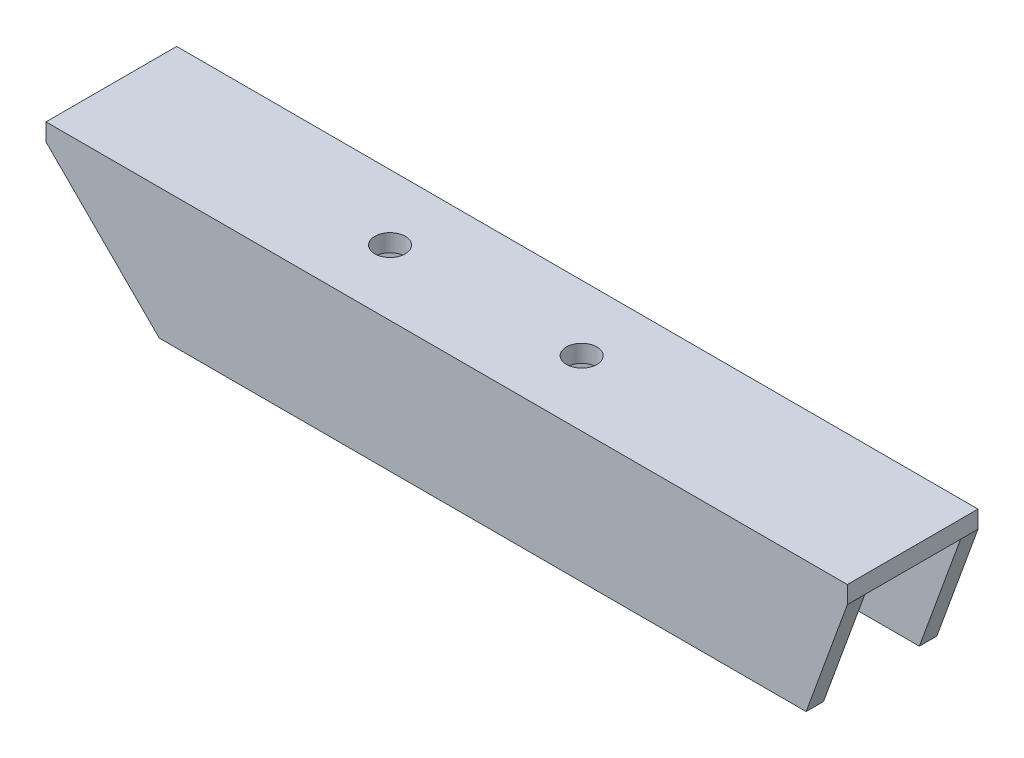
SolidWorks part; units mm, degrees
ref_plane "Front Plane" through (0, 0, 0) normal (0, 0, 1) x (1, 0, 0)
ref_plane "Top Plane" through (0, 0, 0) normal (0, 1, 0) x (1, 0, 0)
ref_plane "Right Plane" through (0, 0, 0) normal (1, 0, 0) x (0, 0, -1)
sketch "Sketch1" plane through (0, 0, 0) normal (1, 0, 0) x (0, 0, -1)
  line L0 (0, 0) -> (0, 15)
  line L1 (0, 15) -> (15, 15)
  line L2 (15, 15) -> (15, 0)
  line L3 (15, 0) -> (13, 0)
  line L4 (13, 0) -> (13, 13)
  line L5 (13, 13) -> (2, 13)
  line L6 (2, 13) -> (2, 0)
  line L7 (2, 0) -> (0, 0)
  dimension "D1" = 2
  dimension "D2" = 2
  dimension "D3" = 2
  dimension "D4" = 15
  dimension "D5" = 15
extrude "Boss-Extrude1" add sketch "Sketch1" along normal blind 92
sketch "Sketch2" plane through (0, 0, 0) normal (0, 0, 1) x (1, 0, 0)
  line L0 (0, 13) -> (13, 0)
  line L1 (92, 0) -> (0, 0) construction
  line L2 (13, 0) -> (0, 0)
  line L3 (0, 0) -> (0, 13)
  line L4 (92, 13) -> (92, 0)
  line L5 (92, 0) -> (87.2684, 0)
  line L6 (87.2684, 0) -> (92, 13)
  dimension "D1" = 45
  dimension "D2" = 70
extrude "Cut-Extrude1" cut sketch "Sketch2" against normal blind 92
sketch "Sketch3" plane through (0, 15, 0) normal (0, 1, 0) x (1, 0, 0)
  line L0 (0, 7.5) -> (92, 7.5) construction
  line L1 (0, 15) -> (0, 0) construction
  line L2 (92, 15) -> (92, 0) construction
  circle A0 centre (32, 7.5) radius 1.75
  circle A1 centre (54, 7.5) radius 1.75
  dimension "D1" = 3.5
  dimension "D2" = 32
  dimension "D3" = 22
extrude "Cut-Extrude2" cut sketch "Sketch3" against normal blind 92
